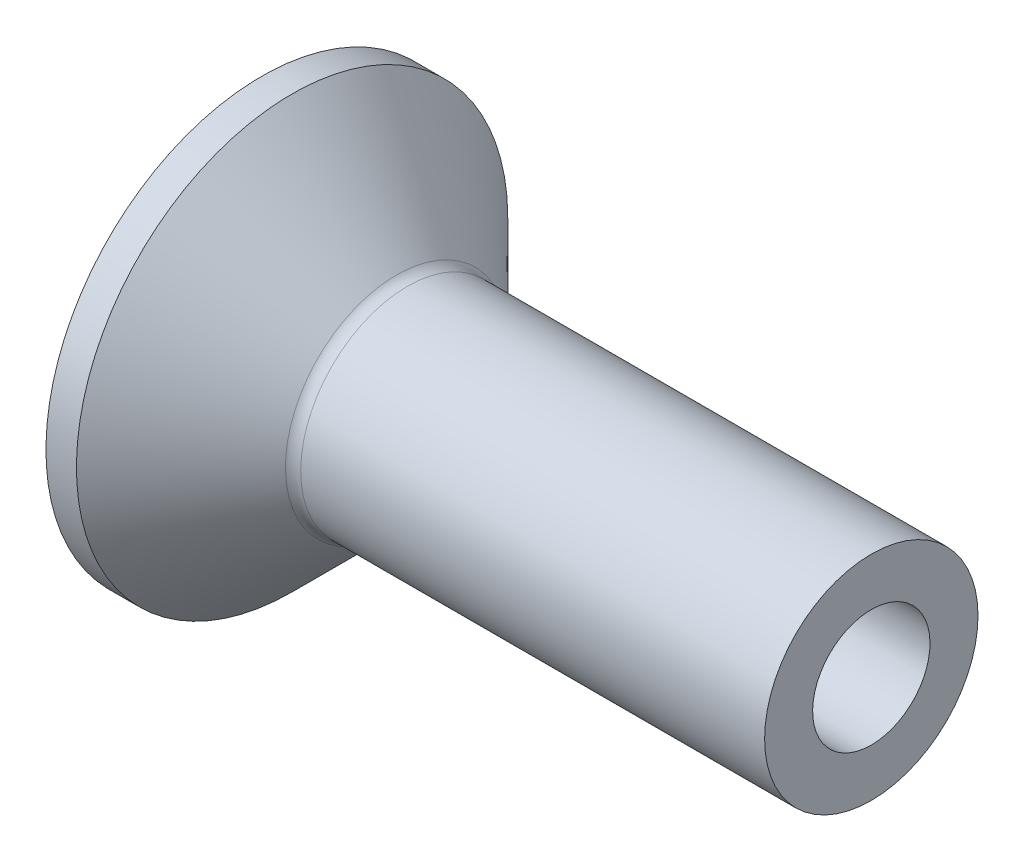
SolidWorks part; units mm, degrees
ref_plane "Front" through (0, 0, 0) normal (0, 0, 1) x (1, 0, 0)
ref_plane "Top" through (0, 0, 0) normal (0, 1, 0) x (1, 0, 0)
ref_plane "Right" through (0, 0, 0) normal (1, 0, 0) x (0, 0, -1)
other "Configuration Table"
sketch "Sketch1" plane through (-0.2925, -1.7075, 0) normal (0, 0, 1) x (0, 1, 0)
  line L0 (1.7075, -0.2925) -> (3.1225, -0.2925)
  line L1 (3.1225, -0.2925) -> (3.1225, -0.4925)
  line L2 (3.1225, -0.4925) -> (2.4075, -1.2075)
  line L3 (2.4075, -1.2075) -> (2.4075, -4.2925)
  line L4 (2.4075, -4.2925) -> (1.7075, -4.2925)
  line L5 (1.7075, -4.2925) -> (1.7075, -0.2925)
  line L6 (1.7075, 2.03) -> (1.7075, -4.03) construction
  dimension "b" = 0.2
  dimension "dk" = 2.83
  dimension "l" = 4
  dimension "d" = 1.4
  dimension "a" = 45
revolve "Base-Revolve" add sketch "Sketch1" angle 360 about L6
fillet "Fillet1" radius 0.1 1 edges at (0.915, -0.7, 0)
sketch "Sketch2" plane through (-3.0606, -3.4456, 0) normal (0, 0, 1) x (0, 1, 0)
  line L0 (3.4456, -1.8755) -> (3.4456, -4.6308) construction
  line L2 (3.4456, -5.6209) -> (3.8306, -5.9006)
  line L3 (3.8306, -5.9006) -> (3.8306, -7.0606)
  line L5 (3.8306, -7.0606) -> (3.4456, -7.0606)
  line L6 (3.4456, -5.6209) -> (3.4456, -7.0606)
  line L7 (2.7456, -7.0606) -> (4.1456, -7.0606) construction
  dimension "dt" = 0.77
  dimension "D2" = 54
  dimension "t" = 1.16
revolve "Cut-Revolve1" cut sketch "Sketch2" angle 360 about L0
